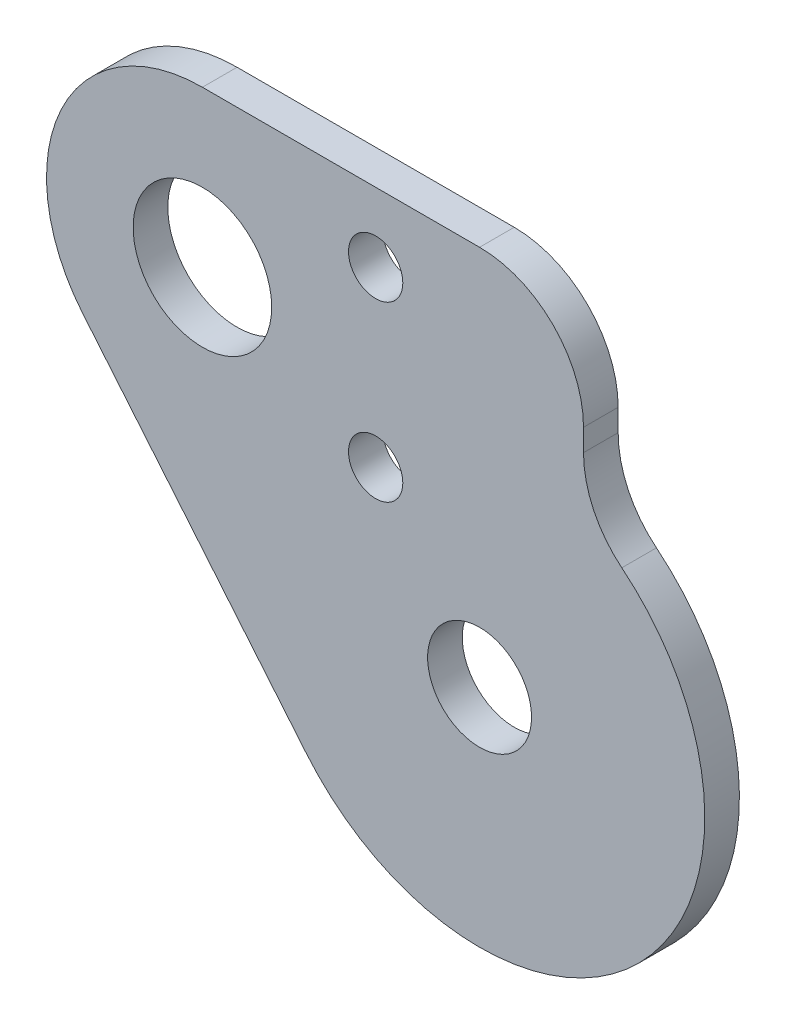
SolidWorks part; units mm, degrees
ref_plane "Front" through (0, 0, 0) normal (0, 0, 1) x (1, 0, 0)
ref_plane "Top" through (0, 0, 0) normal (0, 1, 0) x (1, 0, 0)
ref_plane "Right" through (0, 0, 0) normal (1, 0, 0) x (0, 0, -1)
sketch "Sketch1" plane through (0, 0, 0) normal (0, 0, 1) x (1, 0, 0)
  line L0 (-36.3899, 11.5076) -> (-15.8743, -13.1876)
  line L1 (-25.4, 20.6375) -> (9.525, 20.6375) construction
  line L2 (-25.4, 34.925) -> (9.525, 34.925)
  line L3 (9.525, 34.925) -> (9.525, 18.3079)
  line L4 (-9.525, 28.575) -> (-9.525, 12.7) construction
  circle A0 centre (0, 0) radius 4.7625
  circle A1 centre (-25.4, 20.6375) radius 6.35
  circle A2 centre (-25.4, 20.6375) radius 14.2875 construction
  circle A3 centre (0, 0) radius 20.6375 construction
  arc A4 (-25.4, 34.925) -> (-36.3899, 11.5076) centre (-25.4, 20.6375) ccw
  arc A5 (-15.8743, -13.1876) -> (9.525, 18.3079) centre (0, 0) ccw
  circle A6 centre (-9.525, 28.575) radius 2.4892
  circle A7 centre (-9.525, 12.7) radius 2.4892
  point P19 (-9.525, 20.6375)
  dimension "D1" = 12.7
  dimension "D5" = 9.525
  dimension "D7" = 4.9784
  dimension "D10" = 15.875
  dimension "D2" = 25.4
  dimension "D3" = 20.6375
  dimension "D6" = 34.925
  dimension "D8" = 15.875
  dimension "D9" = 15.875
  dimension "D4" = 7.9375
extrude "Boss-Extrude1" add sketch "Sketch1" along normal blind 3.175
fillet "Fillet1" radius 9.525 2 edges at (9.525, 34.925, 1.5875) (9.525, 18.3079, 1.5875)
